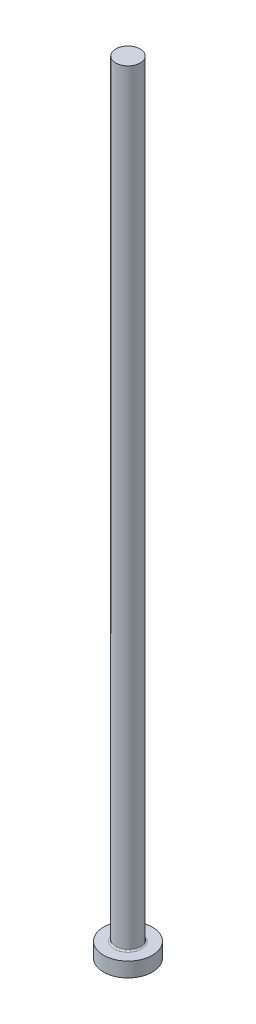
SolidWorks part; units mm, degrees
ref_plane "Plano frontal" through (0, 0, 0) normal (0, 0, 1) x (1, 0, 0)
ref_plane "Plano superior" through (0, 0, 0) normal (0, 1, 0) x (1, 0, 0)
ref_plane "Plano direito" through (0, 0, 0) normal (1, 0, 0) x (0, 0, -1)
sketch "Esboço1" plane through (0, 0, 0) normal (0, 0, 1) x (1, 0, 0)
  line L0 (0, 0) -> (5, 0)
  line L1 (5, 0) -> (5, 3)
  line L2 (5, 3) -> (2.8, 3)
  line L3 (2.5, 3.3) -> (2.5, 160)
  line L4 (2.5, 160) -> (0, 160)
  line L5 (0, 160) -> (0, 0) construction
  line L6 (0, 0) -> (0, 160)
  arc A0 (2.8, 3) -> (2.5, 3.3) centre (2.8, 3.3) cw
  dimension "D3" = 0.3
  dimension "D1" = 10
  dimension "D2" = 5
  dimension "D4" = 3
  dimension "D5" = 160
revolve "Revolução1" add sketch "Esboço1" angle 360 about L5
sketch "Esboço2"
  dimension "D1" = 0.375
  dimension "D2" = 0.875
  dimension "D3" = 0.5625
  dimension "D4" = 2.6875
wrap "Envolver1" sketch "Esboço2" wrap type deboss source sketch "Esboço2" thickness 0.1 parameters "D1"=0.1
